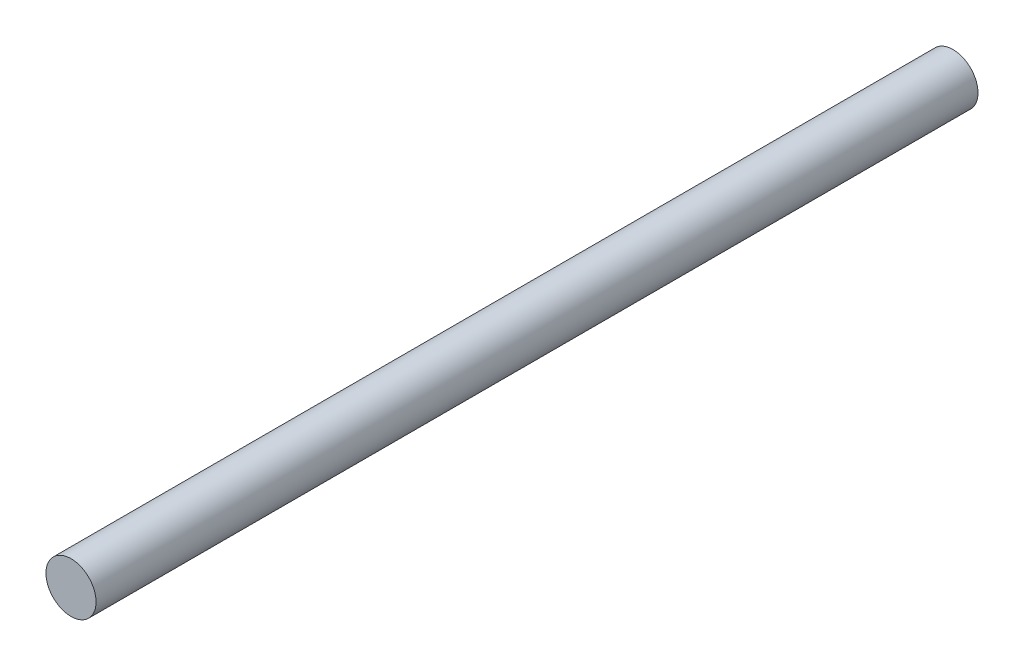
SolidWorks part; units mm, degrees
ref_plane "Front Plane" through (0, 0, 0) normal (0, 0, 1) x (1, 0, 0)
ref_plane "Top Plane" through (0, 0, 0) normal (0, 1, 0) x (1, 0, 0)
ref_plane "Right Plane" through (0, 0, 0) normal (1, 0, 0) x (0, 0, -1)
sketch "Sketch1" plane through (0, 0, 0) normal (0, 0, 1) x (1, 0, 0)
  circle A0 centre (0, 0) radius 1.5875
extrude "Boss-Extrude1" add sketch "Sketch1" along normal mid plane 55.88
